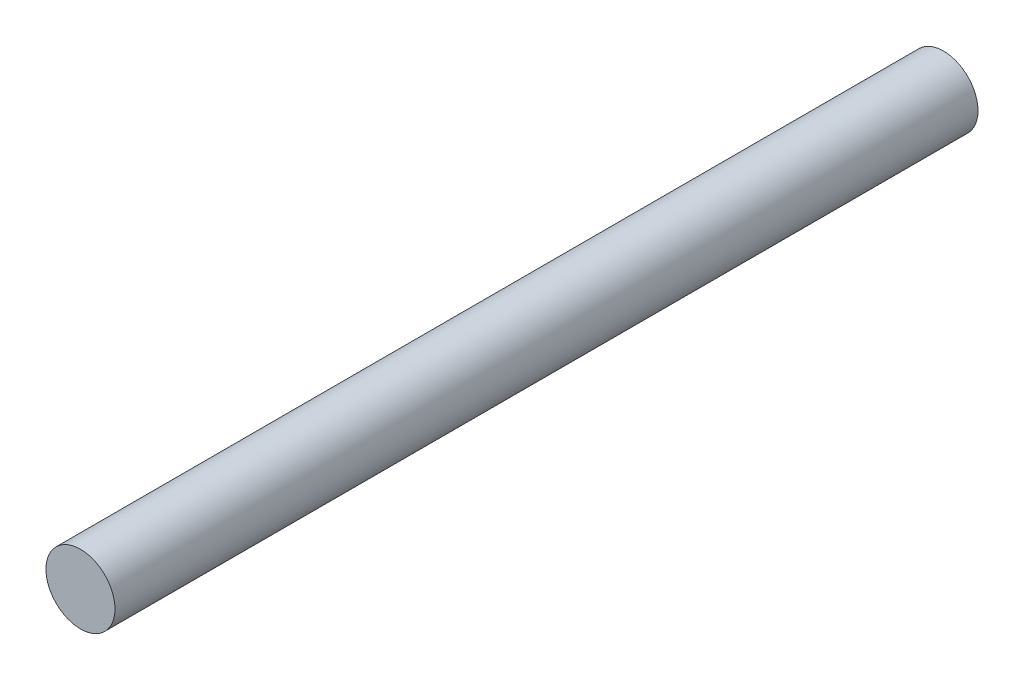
SolidWorks part; units mm, degrees
ref_plane "Ön Düzlem" through (0, 0, 0) normal (0, 0, 1) x (1, 0, 0)
ref_plane "Üst Düzlem" through (0, 0, 0) normal (0, 1, 0) x (1, 0, 0)
ref_plane "Sağ Düzlem" through (0, 0, 0) normal (1, 0, 0) x (0, 0, -1)
sketch "Çizim1" plane through (0, 0, 0) normal (0, 0, 1) x (1, 0, 0)
  circle A0 centre (0, 0) radius 10
  dimension "D1" = 20
extrude "Yükseklik-Ekstrüzyon1" add sketch "Çizim1" along normal blind 250
